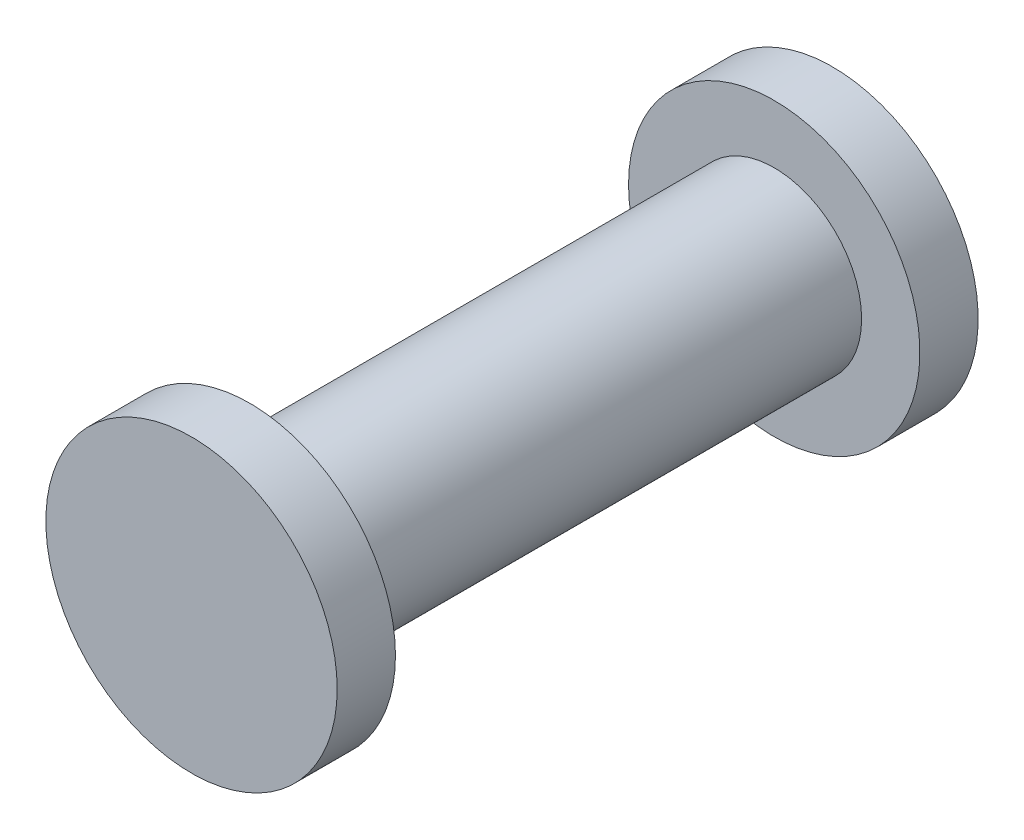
SolidWorks part; units mm, degrees
ref_plane "Plan1" through (0, 0, 0) normal (0, 0, 1) x (1, 0, 0)
ref_plane "Plan2" through (0, 0, 0) normal (0, 1, 0) x (1, 0, 0)
ref_plane "Plan3" through (0, 0, 0) normal (1, 0, 0) x (0, 0, -1)
sketch "Esquisse1" plane through (0, 0, 0) normal (0, 0, 1) x (1, 0, 0)
  circle A0 centre (66.5, 0.4821) radius 1.5 construction
  circle A1 centre (66.5, 0.4821) radius 1.5
extrude "Base-Extrusion" add sketch "Esquisse1" against normal up to surface (9 mm away)
sketch "Esquisse2" plane through (0, 0, -9) normal (0, 0, -1) x (-1, 0, 0)
  circle A2 centre (-66.5, 0.4821) radius 2.5
  circle A3 centre (-66.5, 0.4821) radius 2.5
  dimension "D1" = 1
extrude "Boss.-Extru.1" add sketch "Esquisse2" along normal blind 1
sketch "Esquisse3" plane through (0, 0, 0) normal (0, 0, 1) x (1, 0, 0)
  circle A0 centre (66.5, 0.4821) radius 2.5 construction
  circle A1 centre (66.5, 0.4821) radius 2.5
extrude "Boss.-Extru.2" add sketch "Esquisse3" along normal blind 1
